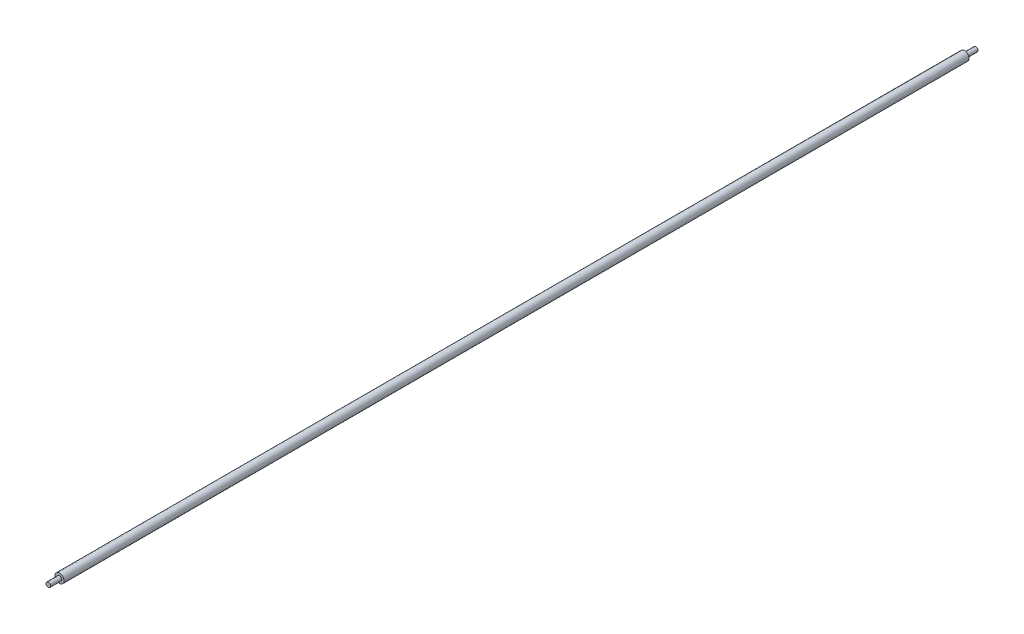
SolidWorks part; units mm, degrees
ref_plane "Front Plane" through (0, 0, 0) normal (0, 0, 1) x (1, 0, 0)
ref_plane "Top Plane" through (0, 0, 0) normal (0, 1, 0) x (1, 0, 0)
ref_plane "Right Plane" through (0, 0, 0) normal (1, 0, 0) x (0, 0, -1)
sketch "Sketch1" plane through (0, 0, 0) normal (0, 0, 1) x (1, 0, 0)
  circle A0 centre (0, 0) radius 5.08
extrude "Boss-Extrude2" add sketch "Sketch1" along normal blind 1020
sketch "Sketch2" plane through (0, 0, 1020) normal (0, 0, 1) x (1, 0, 0)
  circle A0 centre (0, 0) radius 2.54
extrude "Boss-Extrude3" add sketch "Sketch2" along normal blind 12.7
sketch "Sketch3" plane through (0, 0, 0) normal (0, 0, -1) x (-1, 0, 0)
  circle A0 centre (0, 0) radius 2.54
extrude "Boss-Extrude4" add sketch "Sketch3" along normal blind 12.7
